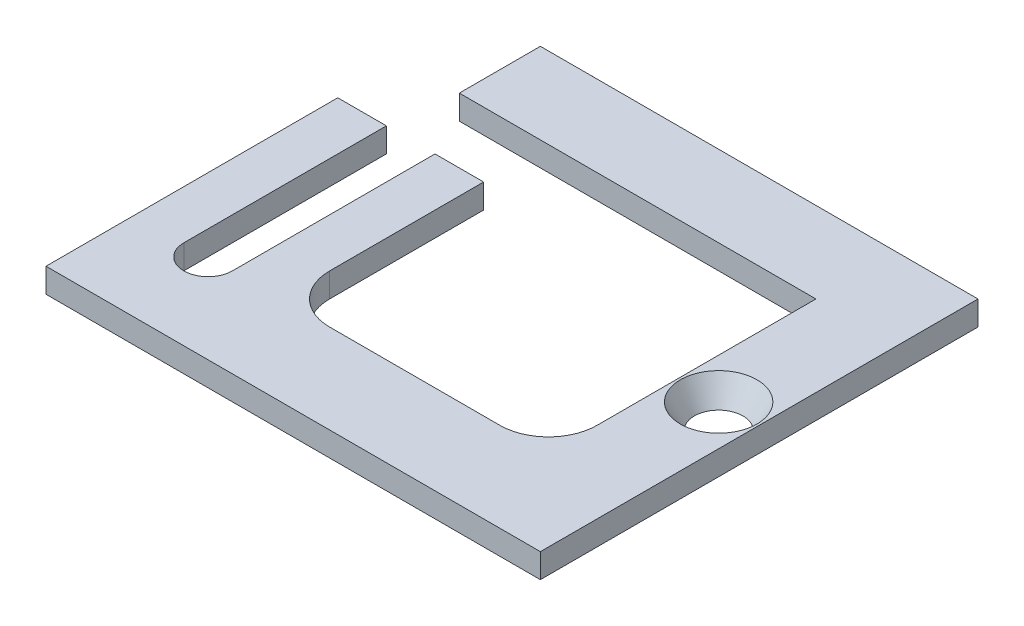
SolidWorks part; units mm, degrees
ref_plane "Front" through (0, 0, 0) normal (0, 0, 1) x (1, 0, 0)
ref_plane "Top" through (0, 0, 0) normal (0, 1, 0) x (1, 0, 0)
ref_plane "Right" through (0, 0, 0) normal (1, 0, 0) x (0, 0, -1)
sketch "Sketch1" plane through (0, 0, 0) normal (0, 1, 0) x (1, 0, 0)
  line L0 (6, 11) -> (6, 36)
  line L1 (0, 0) -> (61, 0)
  line L2 (0, 0) -> (0, 36)
  line L3 (12, 36) -> (18, 36)
  line L4 (61, 0) -> (61, 54)
  line L5 (12, 11) -> (12, 36)
  line L6 (18, 17) -> (18, 36)
  line L7 (51, 17) -> (51, 44)
  line L9 (7, 44) -> (7, 54)
  line L10 (0, 36) -> (6, 36)
  line L14 (7, 54) -> (61, 54)
  line L15 (24, 11) -> (45, 11)
  line L17 (12, 0) -> (12, 54) construction
  line L18 (6, 0) -> (6, 54) construction
  line L19 (51, 0) -> (51, 54) construction
  line L21 (7, 44) -> (51, 44)
  line L24 (18, 0) -> (18, 54) construction
  line L28 (0, 0) -> (0, 54) construction
  circle A0 centre (56, 27) radius 3
  arc A1 (6, 11) -> (12, 11) centre (9, 11) ccw
  arc A2 (24, 11) -> (18, 17) centre (24, 17) cw
  arc A3 (51, 17) -> (45, 11) centre (45, 17) cw
extrude "Extrude1" add sketch "Sketch1" along normal blind 3
draft "Draft6" type of draft neutral plane draft angle 30 faces to draft 1 parameters "D1"=30
